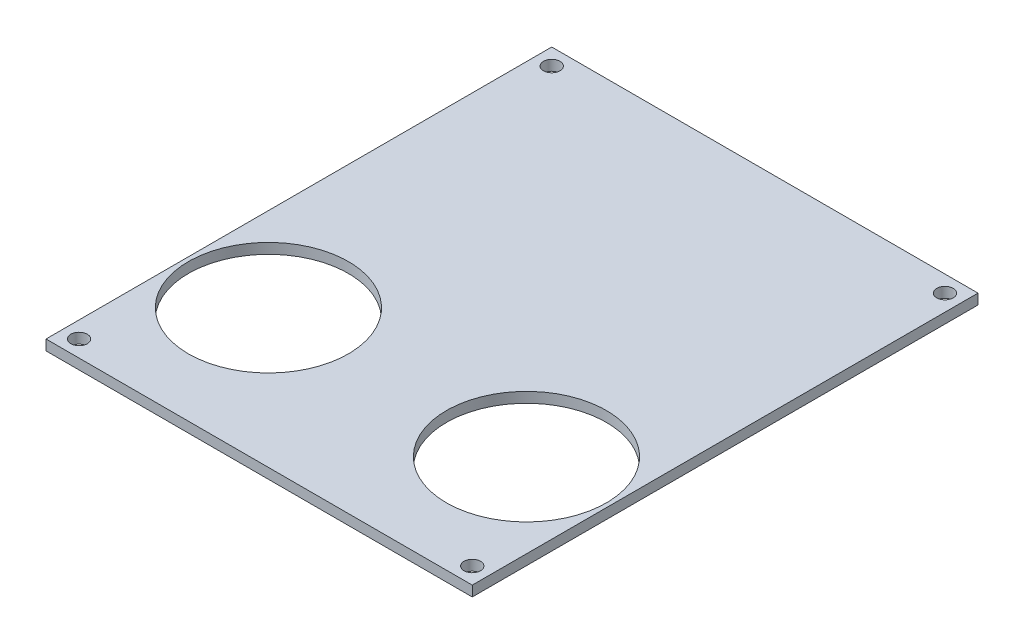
SolidWorks part; units mm, degrees
ref_plane "Front Plane" through (0, 0, 0) normal (0, 0, 1) x (1, 0, 0)
ref_plane "Top Plane" through (0, 0, 0) normal (0, 1, 0) x (1, 0, 0)
ref_plane "Right Plane" through (0, 0, 0) normal (1, 0, 0) x (0, 0, -1)
sketch "Sketch1" plane through (0, 0, 0) normal (0, 1, 0) x (1, 0, 0)
  line L1 (41.3, 49) -> (-41.3, 49)
  line L2 (41.3, 49) -> (41.3, -49)
  line L3 (41.3, -49) -> (-41.3, -49)
  line L4 (-41.3, 49) -> (-41.3, -49)
  line L5 (41.3, 49) -> (-41.3, -49) construction
  line L6 (41.3, -49) -> (-41.3, 49) construction
  point P0 (0, 0)
  dimension "D1" = 82.6
  dimension "D2" = 98
extrude "Boss-Extrude1" add sketch "Sketch1" along normal blind 2
hole_wizard "Ø3.2 (3.2) Diameter Hole1" positions "Sketch3" profile "Sketch2" hole size "Ø3.2" standard "ISO"
sketch "Sketch3" plane through (0, 2, 0) normal (0, 1, 0) x (1, 0, 0)
  line L0 (-41.3, 49) -> (-41.3, -49) construction
  line L1 (41.3, 49) -> (-41.3, 49) construction
  line L2 (41.3, -49) -> (41.3, 49) construction
  line L3 (-41.3, -49) -> (41.3, -49) construction
  point P0 (-38.1, 45.8)
  point P2 (38.1, 45.8)
  point P4 (38.1, -45.8)
  point P6 (-38.1, -45.8)
  dimension "D1" = 3.2
  dimension "D2" = 3.2
  dimension "D3" = 3.2
  dimension "D4" = 3.2
  dimension "D5" = 3.2
  dimension "D6" = 3.2
  dimension "D7" = 3.2
  dimension "D8" = 3.2
sketch "Sketch2" plane through (-38.1, 2, -45.8) normal (1, 0, 0) x (0, 0, 1)
  line L0 (0, 0) -> (0, 2)
  line L1 (0, 2) -> (1.6, 2)
  line L2 (1.6, 2) -> (1.6, 0)
  line L5 (1.6, 0) -> (0, 0)
  line L11 (0, -6.35) -> (0, 107.95) construction
  dimension "Thru Hole Dia." = 3.2
  dimension "Thru Hole Depth" = 2
sketch "Sketch4" plane through (0, 2, 0) normal (0, 1, 0) x (1, 0, 0)
  line L0 (-41.3, -49) -> (41.3, -49) construction
  line L3 (-41.3, 49) -> (-41.3, -49) construction
  circle A0 centre (-25, -22.2) radius 15.5
  circle A1 centre (25, -22.2) radius 15.5
  dimension "D1" = 31
  dimension "D2" = 31
  dimension "D3" = 26.8
  dimension "D4" = 50
  dimension "D6" = 16.3
extrude "Cut-Extrude1" cut sketch "Sketch4" against normal blind 2
